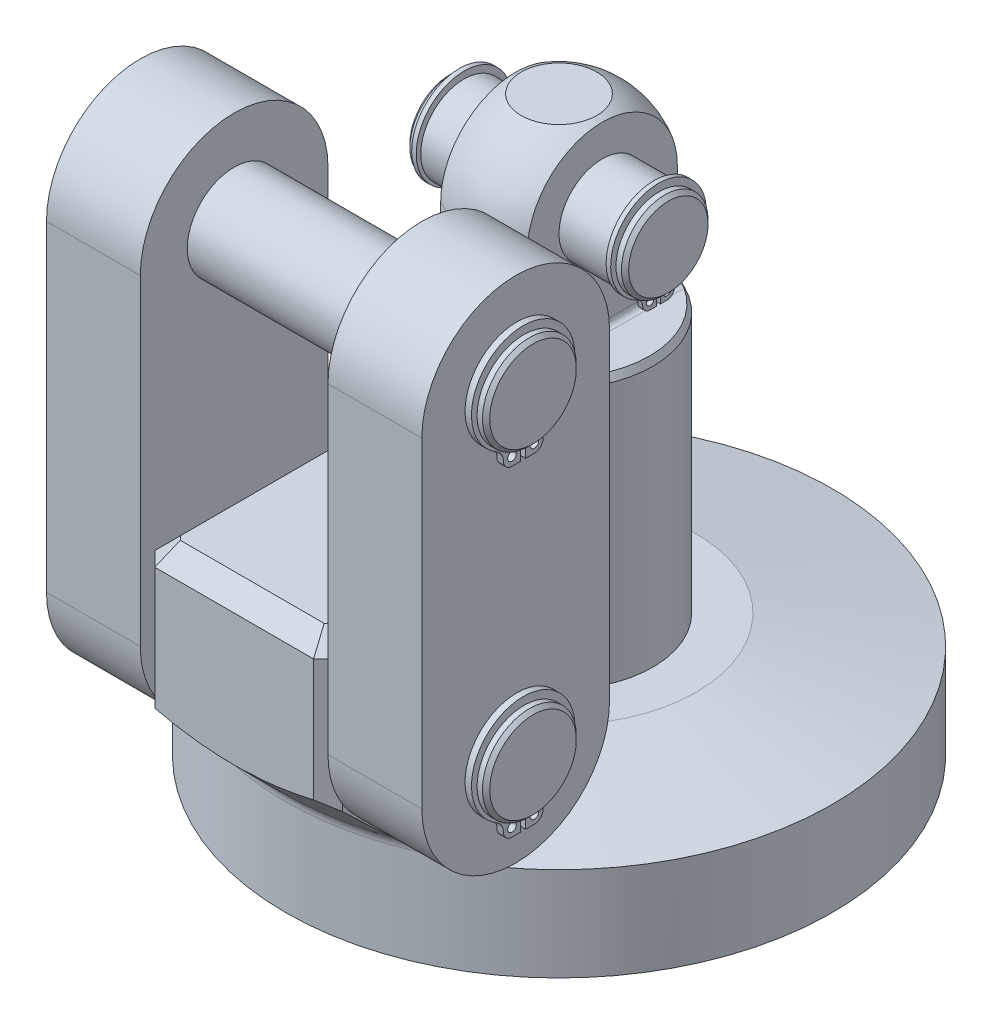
SolidWorks part; units mm, degrees
ref_plane "Front Plane" through (0, 0, 0) normal (0, 0, 1) x (1, 0, 0)
ref_plane "Top Plane" through (0, 0, 0) normal (0, 1, 0) x (1, 0, 0)
ref_plane "Right Plane" through (0, 0, 0) normal (1, 0, 0) x (0, 0, -1)
sketch "Sketch1" plane through (0, 0, 0) normal (0, 1, 0) x (1, 0, 0)
  line L0 (-13, 0) -> (13, 0)
  line L1 (13, 0) -> (13, -45)
  line L2 (13, -45) -> (-13, -45)
  line L3 (-13, -45) -> (-13, 0)
  line L4 (0, 1.05) -> (0, -22.05) construction
  dimension "D1" = 26
  dimension "D2" = 45
extrude "Extrude1" add sketch "Sketch1" along normal blind 42
sketch "S2D0003" plane through (0, 0, 0) normal (1, 0, 0) x (0, 0, -1)
  line L0 (0, 0) -> (0, 17)
  line L1 (-45, 0) -> (0, 0)
  line L2 (-45, 0) -> (-45, 11.4735)
  line L3 (0, 17) -> (-19, 17)
  line L4 (-19, 17) -> (-45, 11.4735)
  line L5 (0, 9.45) -> (0, -2.5987) construction
  line L6 (0, 42) -> (0, 0) construction
  line L8 (-45, 0) -> (0, 0) construction
  line L10 (-45, 42) -> (-45, 0) construction
  dimension "D1" = 17
  dimension "D2" = 12
  dimension "D3" = 38
sketch "S2D0004" plane through (0, 0, 0) normal (1, 0, 0) x (0, 0, -1)
  line L0 (-50, 26.2634) -> (-38.4608, 14.7242)
  line L1 (-37.875, 13.31) -> (-37.875, 0)
  line L2 (0, 16.6313) -> (0, -1.1122) construction
  line L3 (0, 42) -> (0, 0) construction
  line L5 (-45, 0) -> (0, 0) construction
  line L6 (-50, 26.2634) -> (-50, 0)
  line L7 (-50, 0) -> (-37.875, 0)
  line L8 (-45, 42) -> (-45, 0) construction
  arc A0 (-37.875, 13.31) -> (-38.4608, 14.7242) centre (-39.875, 13.31) ccw
  dimension "D4" = 2
  dimension "D1" = 75.75
  dimension "D2" = 13.31
  dimension "D3" = 45
  dimension "D5" = 5
sketch "Sketch4" plane through (0, 0, 0) normal (1, 0, 0) x (0, 0, -1)
  line L0 (0, 17) -> (19, 17)
  line L1 (19, 17) -> (19, 42)
  line L2 (19, 42) -> (0, 42)
  line L3 (0, 42) -> (0, 17)
  line L4 (0, 21.6) -> (0, 8.4) construction
  line L5 (0, 42) -> (0, 0) construction
  line L6 (-45, 42) -> (0, 42) construction
  dimension "D1" = 38
  dimension "D2" = 25
revolve "Cut-Revolve5" cut sketch "Sketch4" angle 360 about L4
revolve "Revolve1" add sketch "S2D0003" angle 360 about L5
revolve "Cut-Revolve4" cut sketch "S2D0004" angle 360 about L2
sketch "Sketch7" plane through (13, 0, 0) normal (1, 0, 0) x (0, 0, -1)
  line L0 (-37.875, 0) -> (37.875, 0) construction
  circle A0 centre (-32, 29) radius 6.5
  dimension "D1" = 13
  dimension "D2" = 29
  dimension "D3" = 32
extrude "Cut-Extrude3" cut sketch "Sketch7" against normal through all
fillet "Fillet1" radius 3.5 2 edges at (-13, 29.5, 13.8564) (13, 29.5, 13.8564)
fillet "Fillet2" radius 4.76 5 edges at (-11.2985, 16.6299, 17.3935) (0, 17, 19) (11.3344, 16.6219, 17.4153)
chamfer "Chamfer1" distance 2 angle 45 2 edges at (-13, 32.5518, 45) (13, 32.5518, 45)
chamfer "Chamfer2" distance 2.5 angle 45 8 edges at (-13, 42, 31.698) (-11.3812, 42, 17.4446) (0, 42, 19) (11.3812, 42, 17.4446) (-12, 42, 44) (13, 42, 31.698) (12, 42, 44) (0, 42, 45)
ref_plane "Plane1" through (0, 0, 32) normal (0, 0, 1) x (1, 0, 0)
sketch "Sketch8" plane through (0, 0, 32) normal (0, 0, 1) x (1, 0, 0)
  line L0 (13, 29) -> (13, 15.5)
  line L1 (14.14, 14.36) -> (27.64, 14.36)
  line L2 (27.64, 14.36) -> (27.64, 29)
  line L3 (27.64, 29) -> (13, 29)
  line L4 (5.637, 29) -> (19.4125, 29) construction
  line L5 (-13, 29) -> (13, 29) construction
  line L6 (13, 42) -> (13, 23.1036) construction
  line L7 (0, 0) -> (0, 26.6501) construction
  line L8 (-27.64, 29) -> (-13, 29)
  line L9 (-27.64, 14.36) -> (-27.64, 29)
  line L10 (-14.14, 14.36) -> (-27.64, 14.36)
  line L11 (-13, 29) -> (-13, 15.5)
  arc A0 (13, 15.5) -> (14.14, 14.36) centre (14.14, 15.5) ccw
  arc A1 (-13, 15.5) -> (-14.14, 14.36) centre (-14.14, 15.5) cw
  dimension "D4" = 1.14
  dimension "D2" = 29.28
  dimension "D3" = 14.64
revolve "Cut-Revolve6" cut sketch "Sketch8" angle 360 about L4
sketch "Sketch10" plane through (0, 0, 0) normal (1, 0, 0) x (0, 0, -1)
  line L0 (0, 17) -> (0, 79.3)
  line L1 (0, 79.3) -> (5.2307, 79.3)
  line L2 (12, 68.5) -> (12, 55.2445)
  line L3 (12, 55.2445) -> (13, 53.1)
  line L4 (13, 53.1) -> (13, 17)
  line L5 (13, 17) -> (0, 17)
  line L6 (0, 44.745) -> (0, 7.55) construction
  line L7 (22.759, -19) -> (-24.5324, -19) construction
  line L9 (19, 17) -> (-13.1126, 17) construction
  arc A0 (12, 68.5) -> (5.2307, 79.3) centre (0, 68.5) ccw
  circle A1 centre (0, 68.5) radius 6 construction
  dimension "D2" = 12
  dimension "D3" = 12
  dimension "D5" = 87.5
  dimension "D1" = 10.8
  dimension "D4" = 36
  dimension "D6" = 26
  dimension "D7" = 24
  dimension "D8" = 25
  dimension "D9" = 26.2
revolve "Revolve2" add sketch "Sketch10" angle 360 about L6
sketch "Sketch12" plane through (0, 0, 0) normal (0, 0, 1) x (1, 0, 0)
  line L0 (6, 79.3) -> (13, 79.3)
  line L1 (13, 79.3) -> (13, 54.1)
  line L2 (13, 54.1) -> (6.8, 54.1)
  line L3 (6, 54.9) -> (6, 79.3)
  line L4 (5.2307, 79.3) -> (-5.2307, 79.3) construction
  line L5 (13, 17) -> (13, 53.1) construction
  line L6 (-6, 54.9) -> (-6, 79.3)
  line L7 (-13, 54.1) -> (-6.8, 54.1)
  line L8 (0, 38.525) -> (0, 26.975) construction
  line L9 (-13, 79.3) -> (-13, 54.1)
  line L10 (-6, 79.3) -> (-13, 79.3)
  arc A0 (6, 54.9) -> (6.8, 54.1) centre (6.8, 54.9) ccw
  arc A1 (-6, 54.9) -> (-6.8, 54.1) centre (-6.8, 54.9) cw
  dimension "D3" = 0.8
  dimension "D1" = 12
  dimension "D2" = 25.2
extrude "Cut-Extrude5" cut sketch "Sketch12" against normal mid plane 22
sketch "Sketch14" plane through (6, 0, 0) normal (1, 0, 0) x (0, 0, -1)
  line L0 (5.2307, 79.3) -> (-5.2307, 79.3) construction
  circle A0 centre (0, 68.5) radius 6
  dimension "D2" = 12
  dimension "D1" = 10.8
extrude "Cut-Extrude7" cut sketch "Sketch14" against normal up to next
sketch "S2D0005" plane through (13, 0, 0) normal (1, 0, 0) x (0, 0, -1)
  line L0 (-45, 73.5) -> (-45, 29)
  line L1 (-19, 73.5) -> (-19, 29)
  line L2 (-32, 73.5) -> (-32, 29) construction
  line L3 (0, 68.5) -> (0, 73.5) construction
  line L4 (0, 73.5) -> (-32, 73.5) construction
  arc A0 (-19, 73.5) -> (-45, 73.5) centre (-32, 73.5) ccw
  arc A1 (-45, 29) -> (-19, 29) centre (-32, 29) ccw
  circle A2 centre (-32, 73.5) radius 6.5
  circle A3 centre (-32, 29) radius 6.5
  circle A6 centre (-32, 29) radius 6.5 construction
  dimension "D2" = 44.5
  dimension "D1" = 26
  dimension "D3" = 32
  dimension "D4" = 5
extrude "Extrude2" add sketch "S2D0005" along normal blind 13
sketch "S2D0006" plane through (0, 0, 0) normal (0, 0, 1) x (1, 0, 0)
  line L0 (-13.15, 74.5) -> (13.15, 74.5)
  line L1 (15.15, 74) -> (15.15, 68.5)
  line L2 (14.65, 74.5) -> (15.15, 74)
  line L3 (13.89, 74.5) -> (14.65, 74.5)
  line L4 (13.89, 74.125) -> (13.89, 74.5)
  line L5 (13.15, 74.125) -> (13.89, 74.125)
  line L6 (13.15, 74.5) -> (13.15, 74.125)
  line L7 (15.15, 68.5) -> (-15.15, 68.5)
  line L8 (-13.15, 74.5) -> (-13.15, 74.125)
  line L9 (-13.15, 74.125) -> (-13.89, 74.125)
  line L10 (-13.89, 74.125) -> (-13.89, 74.5)
  line L11 (-13.89, 74.5) -> (-14.65, 74.5)
  line L12 (-14.65, 74.5) -> (-15.15, 74)
  line L13 (-15.15, 74) -> (-15.15, 68.5)
  line L14 (-8.415, 68.5) -> (8.415, 68.5) construction
  line L15 (-6, 68.5) -> (6, 68.5) construction
  line L16 (0, 40.8686) -> (0, 24.9357) construction
  line L17 (0, 55.2445) -> (0, 68.5) construction
  line L18 (6, 74.5) -> (-6, 74.5) construction
  dimension "D1" = 30.3
  dimension "D3" = 0.74
  dimension "D4" = 11.25
  dimension "D5" = 26.3
  dimension "D6" = 0.5
  dimension "D7" = 45
revolve "Revolve3" add sketch "S2D0006" angle 360 about L14
ref_plane "Plane2" through (0, 0, 32) normal (0, 0, 1) x (1, 0, 0)
sketch "Sketch18" plane through (0, 0, 32) normal (0, 0, 1) x (1, 0, 0)
  line L0 (-26.15, 35.5) -> (26.15, 35.5)
  line L1 (28.4, 35) -> (28.4, 29)
  line L2 (27.9, 35.5) -> (28.4, 35)
  line L3 (27.15, 35.5) -> (27.9, 35.5)
  line L4 (27.15, 34.945) -> (27.15, 35.5)
  line L5 (26.15, 34.945) -> (27.15, 34.945)
  line L6 (26.15, 35.5) -> (26.15, 34.945)
  line L7 (-26.15, 35.5) -> (-26.15, 34.945)
  line L8 (-26.15, 34.945) -> (-27.15, 34.945)
  line L9 (-27.15, 34.945) -> (-27.15, 35.5)
  line L10 (-27.15, 35.5) -> (-27.9, 35.5)
  line L11 (-27.9, 35.5) -> (-28.4, 35)
  line L12 (-28.4, 35) -> (-28.4, 29)
  line L13 (-13.915, 29) -> (13.915, 29) construction
  line L14 (-13, 29) -> (26, 29) construction
  line L15 (0, 28.7058) -> (0, -18.8155) construction
  line L16 (-28.4, 29) -> (28.4, 29)
  line L17 (26, 35.5) -> (-13, 35.5) construction
  dimension "D2" = 56.8
  dimension "D3" = 11.89
  dimension "D4" = 1
  dimension "D5" = 52.3
  dimension "D6" = 0.5
  dimension "D7" = 45
revolve "Revolve4" add sketch "Sketch18" angle 360 about L13
sketch "Sketch20" plane through (13.15, 0, 0) normal (1, 0, 0) x (0, 0, -1)
  line L0 (0.2794, 60.8372) -> (1.169, 60.8372)
  line L1 (0.2794, 63.0722) -> (0.2794, 60.8372)
  line L2 (-0.2794, 63.0722) -> (-0.2794, 60.8372)
  line L3 (-0.2794, 60.8372) -> (-1.169, 60.8372)
  line L4 (0, 30.527) -> (0, 23.2449) construction
  arc A0 (0.2794, 63.0722) -> (-0.2794, 63.0722) centre (0, 68.5) ccw
  arc A1 (2.8303, 62.8456) -> (-2.8303, 62.8456) centre (0, 68.8348) ccw
  circle A2 centre (0, 68.5) radius 6 construction
  circle A3 centre (1.169, 61.8782) radius 0.5205
  arc A4 (2.21, 61.8724) -> (1.169, 60.8372) centre (1.169, 61.8782) cw
  arc A5 (-2.21, 61.8724) -> (-2.8303, 62.8456) centre (-3.2931, 61.8663) ccw
  arc A6 (-2.21, 61.8724) -> (-1.169, 60.8372) centre (-1.169, 61.8782) ccw
  circle A7 centre (-1.169, 61.8782) radius 0.5205
  arc A8 (2.21, 61.8724) -> (2.8303, 62.8456) centre (3.2931, 61.8663) cw
  dimension "D1" = 0.5587
  dimension "D2" = 5.435
  dimension "D3" = 6.6242
  dimension "D4" = 0.3348
  dimension "D6" = 1.041
  dimension "D9" = 1.041
  dimension "D10" = 1.0832
  dimension "D7" = 2.338
  dimension "D8" = 6.6218
extrude "Extrude4" add sketch "Sketch20" along normal blind 0.635
sketch "Sketch21" plane through (26.15, 0, 0) normal (1, 0, 0) x (0, 0, -1)
  line L0 (-31.6571, 20.4125) -> (-30.451, 20.4125)
  line L1 (-31.6571, 23.1555) -> (-31.6571, 20.4125)
  line L2 (-32.3429, 23.1555) -> (-32.3429, 20.4125)
  line L3 (-32.3429, 20.4125) -> (-33.549, 20.4125)
  line L4 (-32, 8.8095) -> (-32, 2.732) construction
  line L5 (-45, 73.5) -> (-45, 29) construction
  arc A0 (-31.6571, 23.1555) -> (-32.3429, 23.1555) centre (-32, 29) ccw
  arc A1 (-28.3627, 23.1717) -> (-35.6373, 23.1717) centre (-32, 29.3425) ccw
  circle A2 centre (-30.451, 21.6065) radius 0.597
  arc A3 (-29.257, 21.6065) -> (-30.451, 20.4125) centre (-30.451, 21.6065) cw
  arc A4 (-29.257, 21.6065) -> (-28.3627, 23.1717) centre (-27.4402, 21.6065) cw
  arc A5 (-34.743, 21.6065) -> (-35.6373, 23.1717) centre (-36.5598, 21.6065) ccw
  arc A6 (-34.743, 21.6065) -> (-33.549, 20.4125) centre (-33.549, 21.6065) ccw
  circle A7 centre (-33.549, 21.6065) radius 0.597
  circle A8 centre (-32, 29) radius 6.5 construction
  dimension "D1" = 5.8545
  dimension "D2" = 7.163
  dimension "D3" = 0.3425
  dimension "D7" = 1.194
  dimension "D8" = 1.194
  dimension "D9" = 7.3935
  dimension "D10" = 1.8168
  dimension "D4" = 0.6857
  dimension "D6" = 3.098
extrude "Extrude5" add sketch "Sketch21" along normal blind 0.889
pattern_linear "LPattern1" count 2 spacing 44.5 along (0, 1, 0) of "Extrude5", "Revolve4"
mirror "Mirror1" about plane through (0, 0, 0) normal (1, 0, 0) of "Extrude5", "LPattern1", "Extrude4", "Extrude2"
